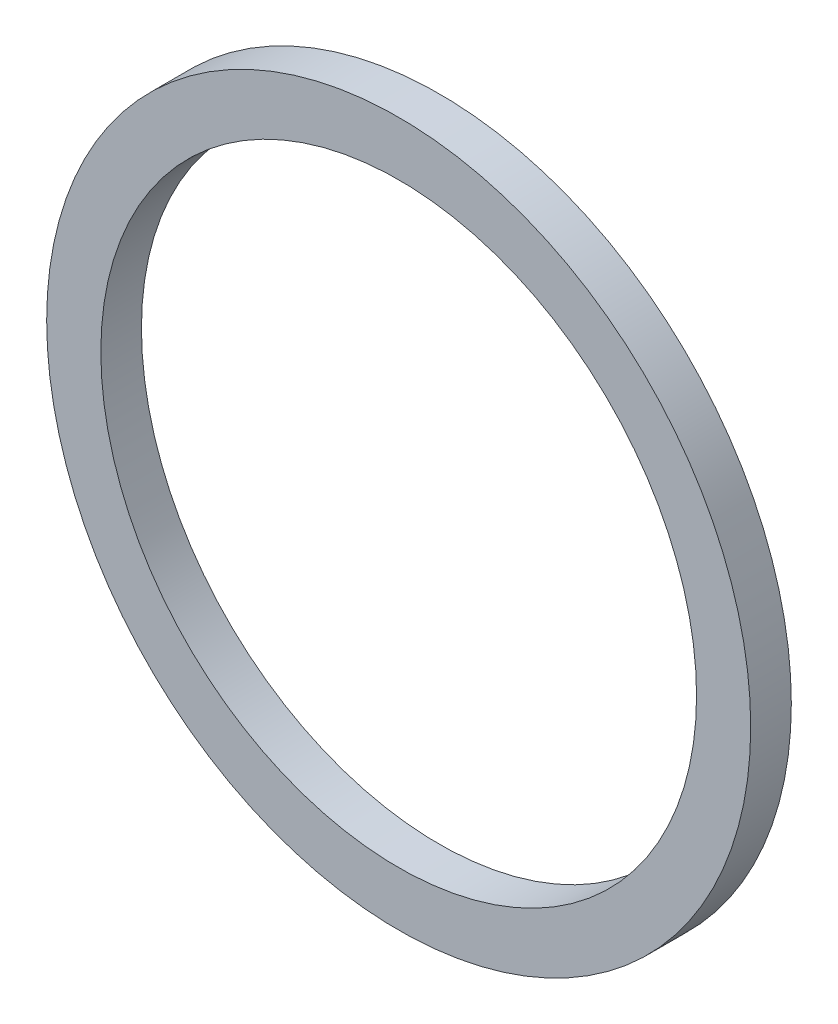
SolidWorks part; units mm, degrees
ref_plane "Plan de face" through (0, 0, 0) normal (0, 0, 1) x (1, 0, 0)
ref_plane "Plan de dessus" through (0, 0, 0) normal (0, 1, 0) x (1, 0, 0)
ref_plane "Plan de droite" through (0, 0, 0) normal (1, 0, 0) x (0, 0, -1)
sketch "Esquisse1" plane through (0, 0, 0) normal (0, 0, 1) x (1, 0, 0)
  circle A0 centre (0, 0) radius 13
  circle A1 centre (0, 0) radius 11
  dimension "D1" = 22
  dimension "D2" = 26
extrude "Extrusion1" add sketch "Esquisse1" along normal blind 1.5
